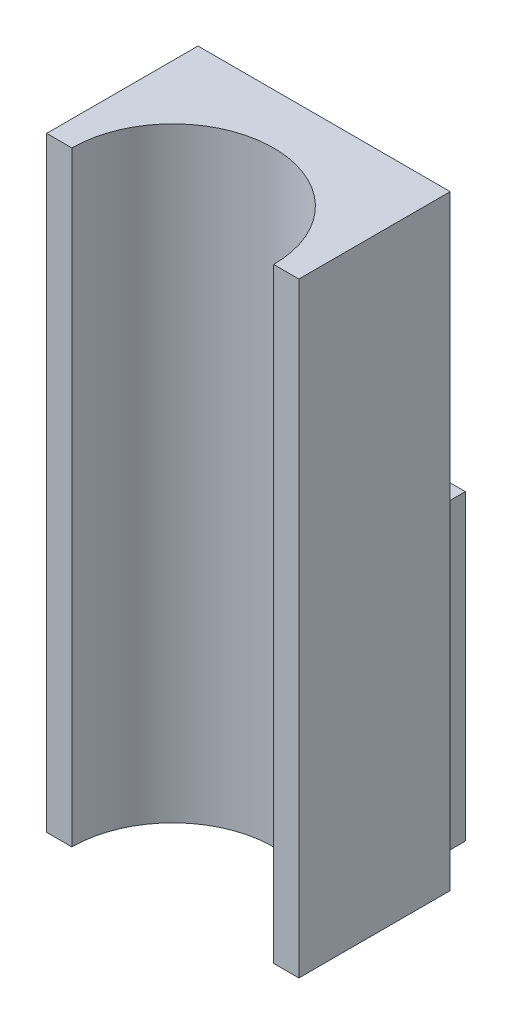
SolidWorks part; units mm, degrees
ref_plane "Front Plane" through (0, 0, 0) normal (0, 0, 1) x (1, 0, 0)
ref_plane "Top Plane" through (0, 0, 0) normal (0, 1, 0) x (1, 0, 0)
ref_plane "Right Plane" through (0, 0, 0) normal (1, 0, 0) x (0, 0, -1)
sketch "Sketch1" plane through (0, 0, 0) normal (0, 0, 1) x (1, 0, 0)
  line L5 (-3.6, 6) -> (3.6, 6)
  line L6 (-3.6, 6) -> (-3.6, -6)
  line L7 (-3.6, -6) -> (3.6, -6)
  line L8 (3.6, 6) -> (3.6, -6)
  line L9 (-3.6, 6) -> (3.6, -6) construction
  line L10 (-3.6, -6) -> (3.6, 6) construction
  point P0 (0, 0)
extrude "Boss-Extrude1" add sketch "Sketch1" along normal blind 2
sketch "Sketch2" plane through (0, 0, 2) normal (0, 0, 1) x (1, 0, 0)
  line L10 (3.6, 6) -> (-3.6, 6) construction
  line L11 (-5, 18) -> (5, 18)
  line L12 (-5, 18) -> (-5, -6)
  line L13 (-5, -6) -> (5, -6)
  line L14 (5, 18) -> (5, -6)
  line L15 (-5, 18) -> (5, -6) construction
  line L16 (-5, -6) -> (5, 18) construction
  point P0 (0, 6)
extrude "Boss-Extrude2" add sketch "Sketch2" along normal blind 6
sketch "Sketch5" plane through (0, 18, 0) normal (0, 1, 0) x (1, 0, 0)
  line L0 (5, -8) -> (-5, -8) construction
  line L1 (-4, -8) -> (4, -8)
  arc A0 (-4, -8) -> (4, -8) centre (0, -8) cw
extrude "Cut-Extrude1" cut sketch "Sketch5" against normal up to surface (24 mm away)
equation "\"rail width\"= 24"
equation "\"system width\"= 125"
equation "\"system depth\"= 250"
equation "\"internal height\"= 100"
equation "\"carriage height\"= 24"
equation "\"belt width\"= 6"
equation "\"worm gear diameter\"= 8"
equation "\"motor mounting hole spacing\" = 35"
equation "\"motor hole radius\"= 4.2"
equation "\"motor diameter\"= 28"
equation "\"rotor shelf diameter\"= 9"
equation "\"rotor centre from motor centre\"= 8"
equation "\"pin radius\"= 2.7"
equation "\"pin spacing\"= 9"
equation "\"D1@Sketch1\"=\"belt width\"*1.2"
equation "\"D2@Sketch1\"=\"rail width\"/2"
equation "\"D1@Sketch2\"=\"rail width\""
equation "\"D2@Sketch2\"=\"worm gear diameter\"+2"
equation "\"D1@Sketch5\"=4"
